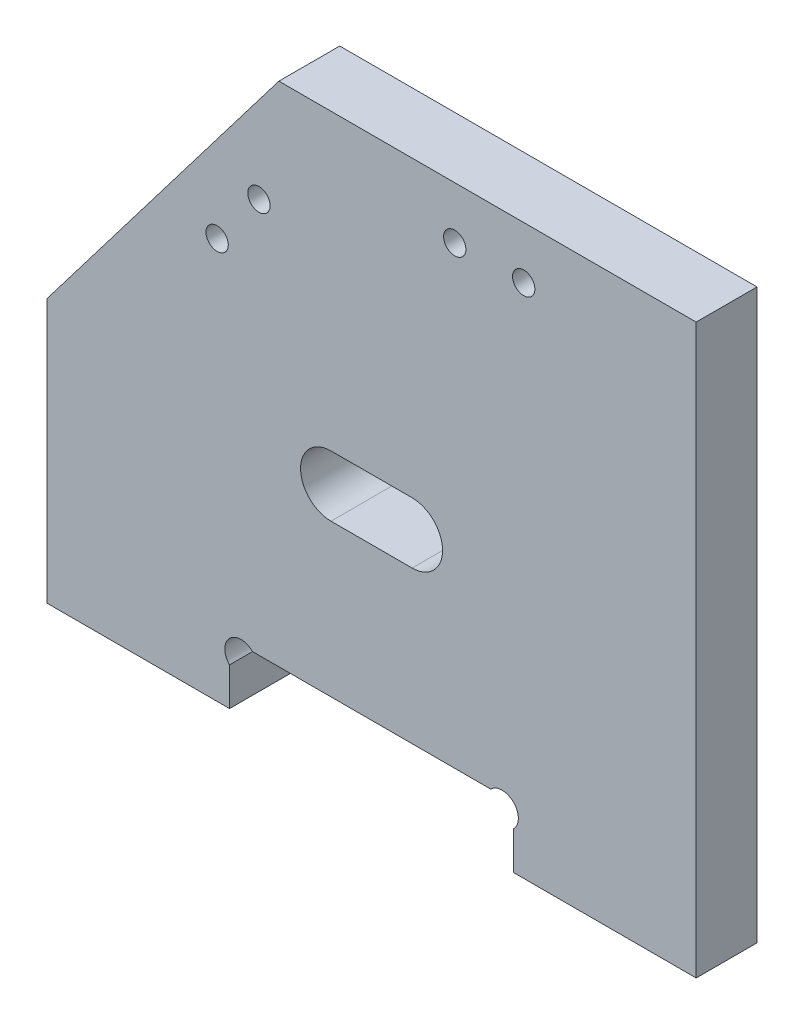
SolidWorks part; units mm, degrees
ref_plane "Plan de face" through (0, 0, 0) normal (0, 0, 1) x (1, 0, 0)
ref_plane "Plan de dessus" through (0, 0, 0) normal (0, 1, 0) x (1, 0, 0)
ref_plane "Plan de droite" through (0, 0, 0) normal (1, 0, 0) x (0, 0, -1)
sketch "Esquisse1" plane through (0, 0, 0) normal (0, 0, 1) x (1, 0, 0)
  line L0 (19.7454, 0) -> (-102.2252, 0) construction
  line L1 (-46, -13.9077) -> (-46, 13.2376) construction
  line L2 (19.7454, 56) -> (-102.2252, 56) construction
  line L3 (-64, -23.8121) -> (-64, 65.486) construction
  line L4 (-103.6946, 26) -> (-64, 26) construction
  line L5 (-64, 26) -> (-31.6765, 68.4153) construction
  line L6 (-102.2252, 6) -> (6.3561, 6) construction
  line L7 (0, 65.486) -> (0, -23.8121) construction
  line L8 (-32, -13.9077) -> (-32, 27.362) construction
  line L9 (-46, 6) -> (-34.0136, -5.9864) construction
  line L10 (-43.7373, 6) -> (-20.2627, 6)
  line L11 (-18, 3.7373) -> (-18, 0)
  line L12 (-46, 3.7373) -> (-46, 0)
  line L13 (-46, 0) -> (-64, 0)
  line L14 (-64, 0) -> (-64, 26)
  line L15 (-64, 26) -> (-41.1378, 56)
  line L16 (-41.1378, 56) -> (0, 56)
  line L17 (0, 56) -> (0, 0)
  line L18 (0, 0) -> (-18, 0)
  line L19 (-41.1378, 56) -> (-32.6597, 49.5391) construction
  line L20 (8.886, 24) -> (-40.3373, 24) construction
  line L21 (-28, 31.2646) -> (-28, 14.1434) construction
  line L22 (-36, 27) -> (-28, 27)
  line L23 (-36, 21) -> (-28, 21)
  arc A0 (-43.7373, 6) -> (-46, 3.7373) centre (-44.8686, 4.8686) ccw
  arc A1 (-20.2627, 6) -> (-18, 3.7373) centre (-19.1314, 4.8686) cw
  arc A2 (-28, 21) -> (-28, 27) centre (-28, 24) ccw
  circle A3 centre (-47.2246, 39.5163) radius 1.1
  circle A4 centre (-43.103, 44.9248) radius 1.1
  circle A5 centre (-23.8, 50.85) radius 1.1
  circle A6 centre (-17, 50.85) radius 1.1
  arc A7 (-36, 21) -> (-36, 27) centre (-36, 24) cw
  dimension "D9" = 90
  dimension "D14" = 4
  dimension "D1" = 56
  dimension "D2" = 64
  dimension "D3" = 37.31
  dimension "D4" = 32
  dimension "D5" = 6
  dimension "D6" = 20
  dimension "D7" = 14
  dimension "D8" = 45
  dimension "D10" = 17
  dimension "D11" = 6.8
  dimension "D12" = 10
  dimension "D13" = 6.8
  dimension "D15" = 18
extrude "Boss.-Extru.1" add sketch "Esquisse1" along normal blind 6
